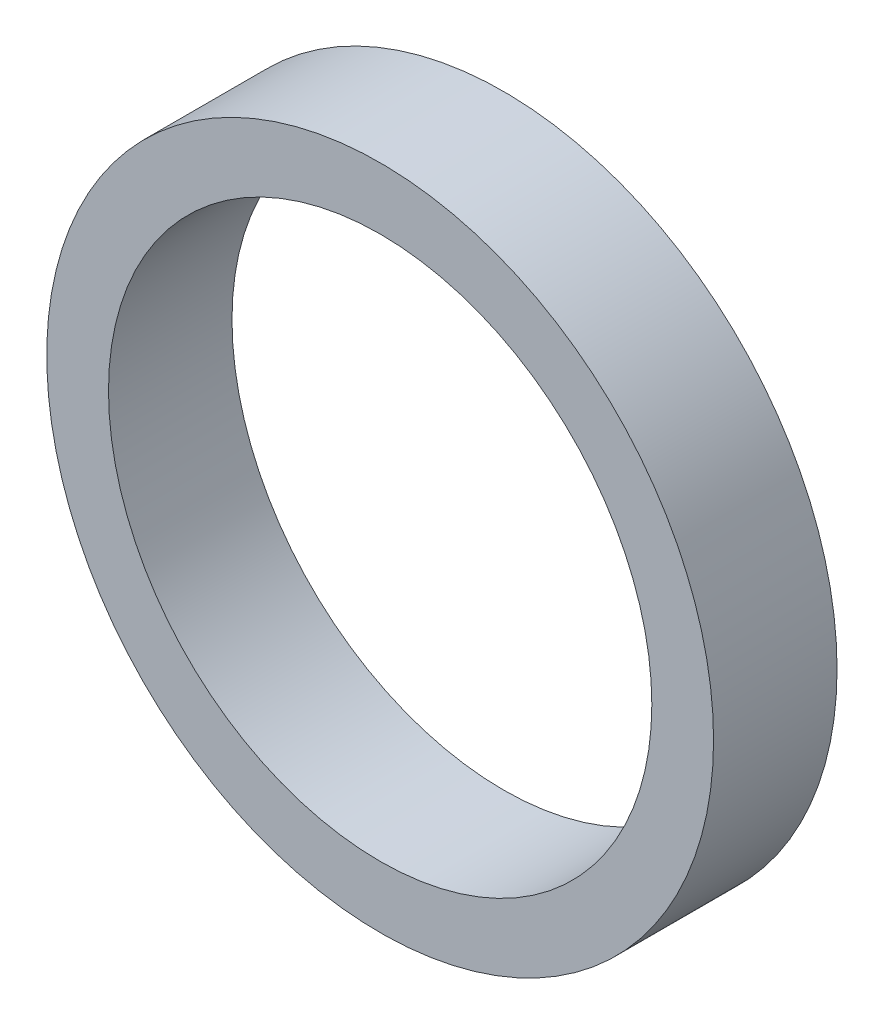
SolidWorks part; units mm, degrees
ref_plane "Face" through (0, 0, 0) normal (0, 0, 1) x (1, 0, 0)
ref_plane "Dessus" through (0, 0, 0) normal (0, 1, 0) x (1, 0, 0)
ref_plane "Droite" through (0, 0, 0) normal (1, 0, 0) x (0, 0, -1)
sketch "Esquisse1" plane through (0, 0, 0) normal (0, 0, 1) x (1, 0, 0)
  circle A0 centre (0, 0) radius 11
  circle A1 centre (0, 0) radius 13.5
  dimension "D1" = 22
  dimension "D2" = 27
extrude "Base-Extrusion" add sketch "Esquisse1" along normal blind 5
